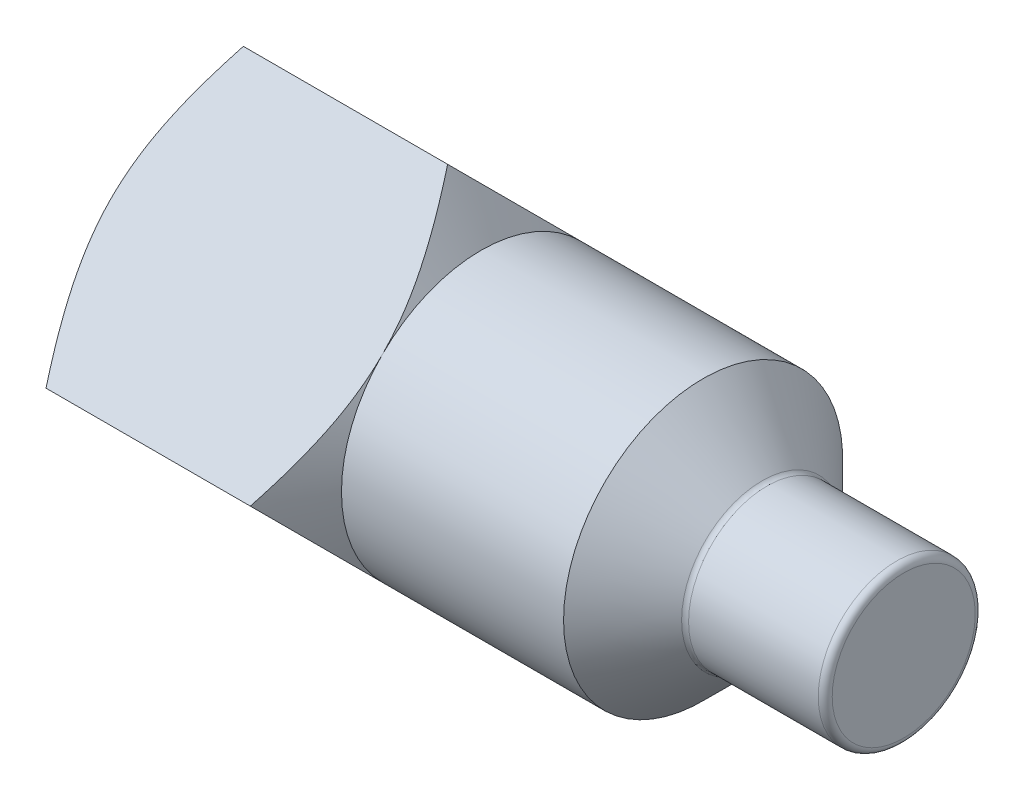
SolidWorks part; units mm, degrees
ref_plane "Front Plane" through (0, 0, 0) normal (0, 0, 1) x (1, 0, 0)
ref_plane "Top Plane" through (0, 0, 0) normal (0, 1, 0) x (1, 0, 0)
ref_plane "Right Plane" through (0, 0, 0) normal (1, 0, 0) x (0, 0, -1)
sketch "BaseHeadSke" plane through (0, 0, 0) normal (1, 0, 0) x (0, 0, -1)
  line L0 (0, 0) -> (14.1701, 0) construction
  line L1 (0, 0) -> (0, 11.9761) construction
  line L2 (0, 2.8284) -> (2.8284, 0)
  line L3 (0, -2.8284) -> (2.8284, 0)
  line L4 (0, 2.8284) -> (-2.8284, 0)
  line L5 (0, -2.8284) -> (-2.8284, 0)
  dimension "Width_flats" = 4
  dimension "Angle" = 45
extrude "BaseHead" add sketch "BaseHeadSke" along normal blind 4
sketch "HeadChamferSke" plane through (0, 0, 0) normal (0, 0, 1) x (1, 0, 0)
  line L0 (0, 0) -> (6.1973, 0) construction
  line L1 (2, 2.8284) -> (2, -3.5627) construction
  line L2 (4, 2.8284) -> (0, 2.8284) construction
  line L3 (0, 2.8284) -> (0, 1.9)
  line L4 (0, 2.8284) -> (0.536, 2.8284)
  line L5 (0.536, 2.8284) -> (0, 1.9)
  line L6 (0, 2.8284) -> (0, 0) construction
  line L7 (3.464, 2.8284) -> (4, 1.9)
  line L8 (4, 2.8284) -> (3.464, 2.8284)
  line L9 (4, 2.8284) -> (4, 1.9)
  dimension "Head_chamfer" = 3.8
  dimension "Angle" = 30
revolve "HeadChamfer" cut sketch "HeadChamferSke" angle 360 about L0
sketch "BodySke" plane through (0, 0, 0) normal (0, 0, 1) x (1, 0, 0)
  line L0 (0, 0) -> (13.1857, 0) construction
  line L1 (4, -1.9) -> (4, 1.9) construction
  line L2 (4, 0) -> (4, 1.9) construction
  line L3 (3.464, 2) -> (10, 2) construction
  line L4 (10, 2) -> (10, 0) construction
  line L5 (4, 1.9) -> (4, 2) construction
  line L6 (3.464, 2) -> (3.464, 0)
  line L7 (3.464, 0) -> (10, 0)
  line L8 (8, 2) -> (8, 1.125)
  line L9 (8, 1.125) -> (10, 1.125)
  line L10 (3.464, 2) -> (8, 2)
  line L11 (10, 1.125) -> (10, 0)
  line L12 (9.3, 2.4466) -> (9.3, -2.0631) construction
  point P14 (3.464, 1.61)
  dimension "Length" = 6
  dimension "Length_Dog" = 2
  dimension "Diameter_Dog" = 2.25
  dimension "Minor_dia" = 3.22
  dimension "Diameter" = 4
  dimension "Advance" = 0.7
revolve "BaseBody" add sketch "BodySke" angle 360 about L0
sketch "ChamferEndSke" plane through (0, 0, 0) normal (0, 0, 1) x (1, 0, 0)
  line L0 (0, 0) -> (11.0843, 0) construction
  line L1 (8, 2) -> (8, 1.125)
  line L2 (8, 2) -> (7.125, 2)
  line L3 (7.125, 2) -> (8, 1.125)
  line L4 (8, 2) -> (3.9423, 2) construction
  dimension "Angle" = 45
revolve "ChamferEnd" cut sketch "ChamferEndSke" angle 360 about L0
sketch "ThdSchSke" plane through (0, 0, 0) normal (0, 0, 1) x (1, 0, 0)
  line L0 (6.425, 2.4503) -> (6.425, 2)
  line L1 (6.425, 2.4503) -> (6.8753, 2.4503)
  line L2 (6.8753, 2.4503) -> (6.8753, 2)
  line L3 (6.8753, 2) -> (6.6502, 1.61)
  line L4 (6.6502, 1.61) -> (6.425, 2)
  line L5 (0, 0) -> (11.8711, 0) construction
  line L9 (7.125, 2) -> (3.9423, 2) construction
  dimension "D1" = 0.7
revolve "ThreadSchematic" [suppressed] cut sketch "ThdSchSke" angle 360 about L5
pattern_linear "ThdSchPat" [suppressed] count 3
fillet "Fillet1" radius 0.1 2 edges at (10, 0, 1.125) (8, 0, 1.125)
equation "\"Minor_dia@ThreadCosmetic\" = \"Minor_dia@BodySke\""
equation "\"D1@ThdSchSke\" = \"Advance@BodySke\""
equation "\"Advance@ThdSchPat\" = \"Advance@BodySke\""
equation "\"D1@ThdSchPat\" =  int( (  \"Length@BodySke\" -  \"Length_Dog@BodySke\" )  /\"Advance@ThdSchPat\" )  - 2"
